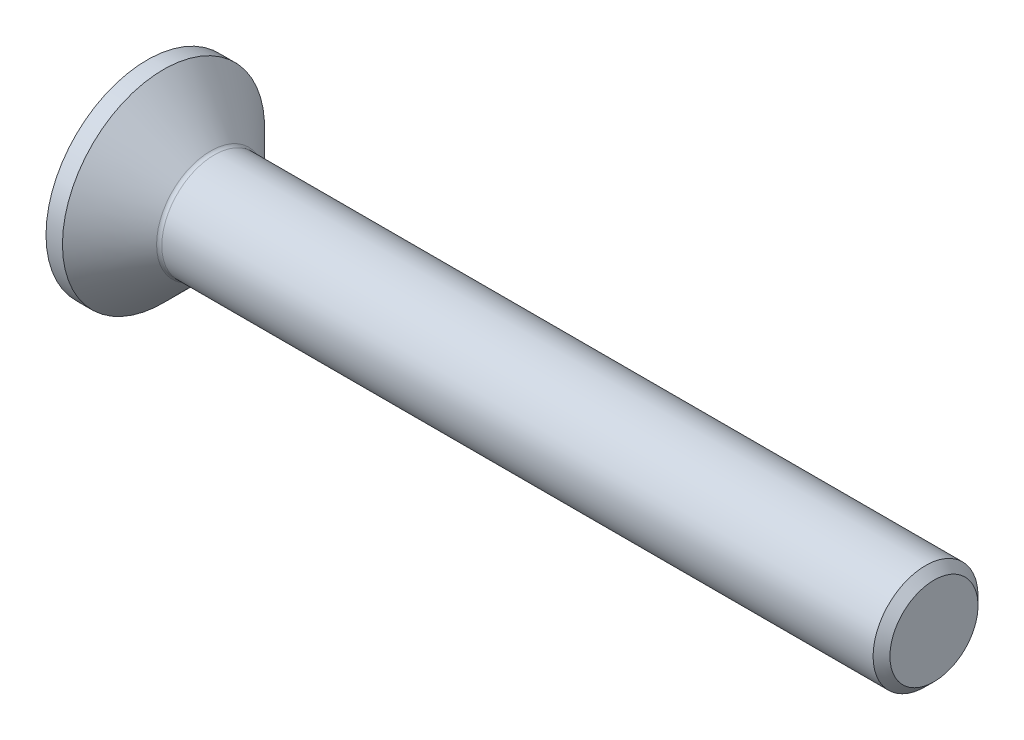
SolidWorks part; units mm, degrees
revolve "PreBroach" cut sketch "Sketch2"
sketch "Sketch2"
  line L0 (0, 4) -> (4.3, 4)
  line L1 (4.3, 4) -> (6.6094, 0)
  line L2 (0, 0) -> (127, 0) construction
  line L3 (6.6094, 0) -> (0, 0)
  line L4 (0, 0) -> (0, 4)
  line L5 (0, -4) -> (4.3, -4) construction
  line L6 (0, 0) -> (47.625, 0) construction
  line L8 (0, 11.56) -> (0, -11.56) construction
revolve "BaseBody" add sketch "BodySke"
sketch "BodySke" plane through (0, 0, 0) normal (0, 0, 1) x (1, 0, 0)
  line L0 (0, 0) -> (0, 11.56)
  line L1 (1.88, 11.56) -> (7.44, 6)
  line L2 (0, 11.56) -> (1.88, 11.56)
  line L3 (7.44, 6) -> (89.036, 6)
  line L4 (90, 5.036) -> (90, 0)
  line L5 (90, 0) -> (0, 0)
  line L6 (0, 0) -> (127, 0) construction
  line L7 (1.88, -11.56) -> (7.44, -6) construction
  line L8 (90, 5.036) -> (89.036, 6)
  line L9 (0, -11.56) -> (1.88, -11.56) construction
  line L10 (90, -5.036) -> (89.036, -6) construction
  line L11 (9.19, 12.35) -> (9.19, -9.875) construction
  line L12 (54, 19.05) -> (54, -3.175) construction
fillet "Fillet1" radius 0.6 1 edges at (7.44, 0, 6)
ref_plane "Plane1" through (0, 0, 0) normal (0, 0, 1) x (1, 0, 0)
ref_plane "Plane2" through (0, 0, 0) normal (0, 1, 0) x (1, 0, 0)
ref_plane "Plane3" through (0, 0, 0) normal (1, 0, 0) x (0, 0, -1)
sketch "Sketch3" plane through (0, 0, 0) normal (-1, 0, 0) x (0, 0, 1)
  line L0 (-4, -2.3094) -> (-4, 2.3094)
  line L1 (-4, 2.3094) -> (0, 4.6188)
  line L2 (0, 4.6188) -> (4, 2.3094)
  line L3 (4, 2.3094) -> (4, -2.3094)
  line L4 (4, -2.3094) -> (0, -4.6188)
  line L5 (0, -4.6188) -> (-4, -2.3094)
extrude "Hex" cut sketch "Sketch3" against normal blind 4.3
sketch "ThdSchSke" plane through (0, 0, 0) normal (0, 0, 1) x (1, 0, 0)
  line L0 (54, -5.036) -> (53.325, -6)
  line L1 (54, -5.036) -> (54.675, -6)
  line L2 (54.675, -6) -> (54.675, -7.5)
  line L3 (-3.175, 0) -> (5.1513, 0) construction
  line L4 (0, 11.56) -> (0, -11.56) construction
  line L5 (54.675, -7.5) -> (53.325, -7.5)
  line L6 (53.325, -7.5) -> (53.325, -6)
revolve "ThreadSchematic" [suppressed] cut sketch "ThdSchSke" angle 360 about L3
pattern_linear "ThdSchPat" [suppressed]
equation "\"Thread_minor@ThreadCosmetic\"  =  \"Minor_dia@BodySke\""
equation "\"D1@Sketch3\" = \"Hex_size@Sketch3\" / 2"
equation "\"D2@Sketch3\" = \"D1@Sketch3\""
equation "\"D3@Sketch3\" = \"Hex_size@Sketch3\""
equation "\"Thread_length@ThreadCosmetic\" = ((sgn( (\"Length@BodySke\" - \"Advance@BodySke\" * 3.0 - \"Head_ht@BodySke\" ) - \"Thread_nom@BodySke\" )-1)*( (\"Length@BodySke\" - \"Advance@BodySke\" * 3.0 - \"Head_ht@BodySke\" "
equation "\"Thread_minor@ThdSchSke\" = \"Minor_dia@BodySke\""
equation "\"Diameter@ThdSchSke\" = \"Diameter@BodySke\""
equation "\"Overcut@ThdSchSke\" = \"Diameter@BodySke\" * 1.25"
equation "\"Start@ThdSchSke\" = 0.000001 + \"Length@BodySke\" - \"Thread_length@ThreadCosmetic\"  '---Countersunk---"
equation "\"Num_threads@ThdSchPat\" = int( \"Thread_length@ThreadCosmetic\" / \"Advance@BodySke\" + 0.999 )  + 1"
equation "\"Advance@ThdSchPat\" = \"Thread_length@ThreadCosmetic\" /  (\"Num_threads@ThdSchPat\" - 1) 'relax it"
equation "\"Num_threads@ThdSchPat\" = \"Num_threads@ThdSchPat\" - sgn( \"Num_threads@ThdSchPat\" - 1) '---chamfered tips only---"
